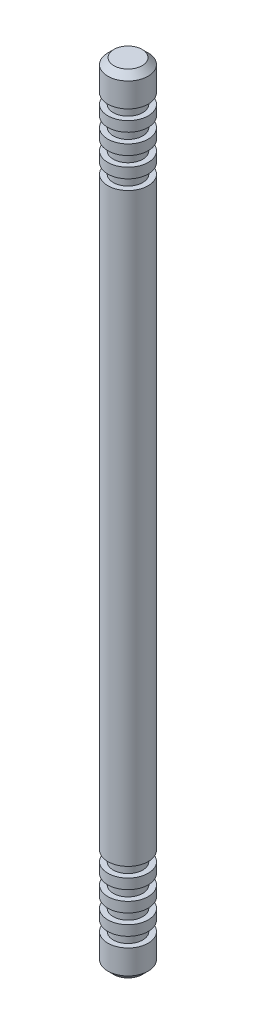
SolidWorks part; units mm, degrees
ref_plane "Face" through (0, 0, 0) normal (0, 0, 1) x (1, 0, 0)
ref_plane "Dessus" through (0, 0, 0) normal (0, 1, 0) x (1, 0, 0)
ref_plane "Droite" through (0, 0, 0) normal (1, 0, 0) x (0, 0, -1)
sketch "Esquisse1" plane through (0, 0, 0) normal (0, 0, 1) x (1, 0, 0)
  line L0 (-26.0926, -54.79) -> (-26.0926, -56.29)
  line L1 (-26.0926, -56.29) -> (-25.8226, -56.29)
  line L2 (-25.8226, -56.29) -> (-25.8226, -56.79)
  line L3 (-25.8226, -56.79) -> (-26.0926, -56.79)
  line L4 (-26.0926, -56.79) -> (-26.0926, -57.29)
  line L5 (-26.0926, -57.29) -> (-25.8226, -57.29)
  line L6 (-25.8226, -57.29) -> (-25.8226, -57.79)
  line L7 (-25.8226, -57.79) -> (-26.0926, -57.79)
  line L8 (-26.0926, -57.79) -> (-26.0926, -58.29)
  line L9 (-26.0926, -58.29) -> (-25.8226, -58.29)
  line L10 (-25.8226, -58.29) -> (-25.8226, -58.79)
  line L11 (-25.8226, -58.79) -> (-26.0926, -58.79)
  line L12 (-26.0926, -58.79) -> (-26.0926, -59.29)
  line L13 (-26.0926, -59.29) -> (-25.8226, -59.29)
  line L14 (-25.8226, -59.29) -> (-25.8226, -59.79)
  line L15 (-25.8226, -59.79) -> (-26.0926, -59.79)
  line L16 (-26.0926, -59.79) -> (-26.0926, -88.79)
  line L17 (-26.0926, -88.79) -> (-25.8226, -88.79)
  line L18 (-25.8226, -88.79) -> (-25.8226, -89.29)
  line L19 (-25.8226, -89.29) -> (-26.0926, -89.29)
  line L20 (-26.0926, -89.29) -> (-26.0926, -89.79)
  line L21 (-26.0926, -89.79) -> (-25.8226, -89.79)
  line L22 (-25.8226, -89.79) -> (-25.8226, -90.29)
  line L23 (-25.8226, -90.29) -> (-26.0926, -90.29)
  line L24 (-26.0926, -90.29) -> (-26.0926, -90.79)
  line L25 (-26.0926, -90.79) -> (-25.8226, -90.79)
  line L26 (-25.8226, -90.79) -> (-25.8226, -91.29)
  line L27 (-25.8226, -91.29) -> (-26.0926, -91.29)
  line L28 (-26.0926, -91.29) -> (-26.0926, -91.79)
  line L29 (-25.8226, -91.79) -> (-26.0926, -91.79)
  line L30 (-25.8226, -91.79) -> (-25.8226, -92.29)
  line L31 (-26.0926, -92.29) -> (-26.0926, -93.79)
  line L32 (-26.0926, -93.79) -> (-25.0926, -93.79)
  line L33 (-25.0926, -93.79) -> (-25.0926, -54.79)
  line L34 (-25.0926, -54.79) -> (-26.0926, -54.79)
  line L35 (-25.8226, -92.29) -> (-26.0926, -92.29)
  line L36 (-25.0926, -54.79) -> (-25.0926, 112.5259) construction
  dimension "D2" = 1.46
  dimension "D3" = 2
  dimension "D4" = 1.5
  dimension "D5" = 0.5
  dimension "D6" = 0.5
  dimension "D7" = 0.5
  dimension "D8" = 0.5
  dimension "D9" = 0.5
  dimension "D10" = 0.5
  dimension "D11" = 0.5
  dimension "D12" = 0.5
  dimension "D13" = 0.5
  dimension "D14" = 0.5
  dimension "D15" = 0.5
  dimension "D16" = 0.5
  dimension "D17" = 0.5
  dimension "D18" = 0.5
  dimension "D19" = 1.5
  dimension "D20" = 39
revolve "Révolution1" add sketch "Esquisse1" angle 360 about L36
chamfer "Chanfrein1" distance 0.3 angle 45 2 edges at (-24.0926, -54.79, 0) (-24.0926, -93.79, 0)
